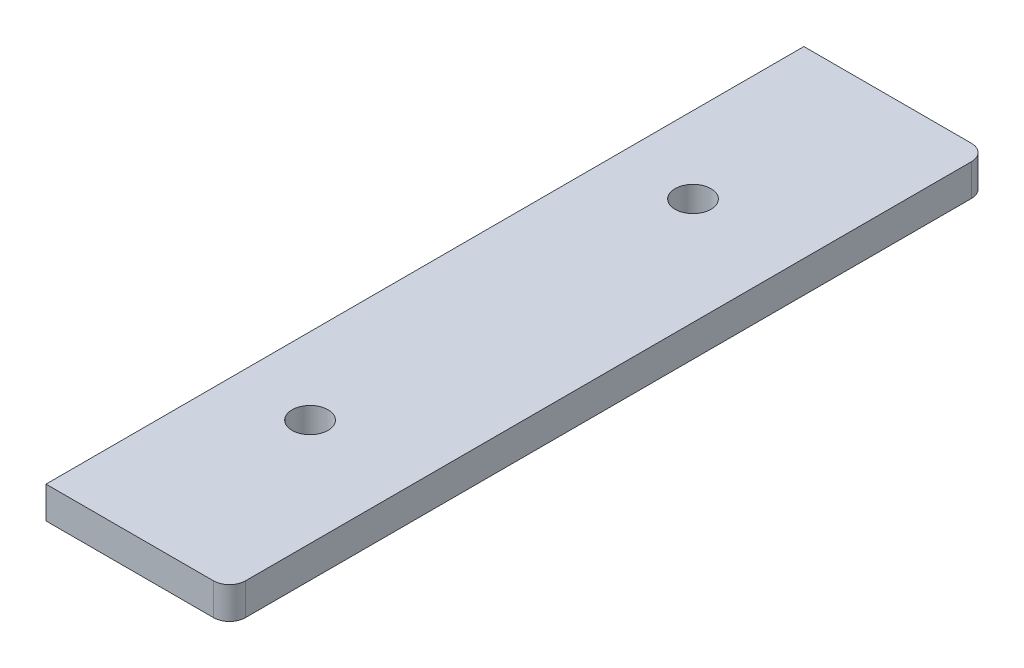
SolidWorks part; units mm, degrees
ref_plane "Front Plane" through (0, 0, 0) normal (0, 0, 1) x (1, 0, 0)
ref_plane "Top Plane" through (0, 0, 0) normal (0, 1, 0) x (1, 0, 0)
ref_plane "Right Plane" through (0, 0, 0) normal (1, 0, 0) x (0, 0, -1)
sketch "Sketch2" plane through (0, 0, 0) normal (0, 1, 0) x (1, 0, 0)
  line L0 (0, 0) -> (-56.1291, 0) construction
  line L1 (-18.2563, -75.4062) -> (18.2562, -75.4062)
  line L2 (-18.2563, -75.4062) -> (-18.2563, 75.4062)
  line L3 (-18.2563, 75.4062) -> (18.2562, 75.4062)
  line L4 (18.2562, -75.4062) -> (18.2562, 75.4062)
  line L5 (-18.2563, -75.4062) -> (18.2562, 75.4062) construction
  line L6 (-18.2563, 75.4062) -> (18.2562, -75.4062) construction
  circle A0 centre (-3.0163, 38.1) radius 3.5719
  circle A1 centre (-3.0162, -38.1) radius 3.5719
  point P0 (0, 0)
  point P10 (0, 0)
  point P13 (0, 0)
  point P14 (0, 0)
  point P15 (24.6062, 75.4062)
  dimension "D3" = 7.1437
  dimension "D1" = 150.8125
  dimension "D2" = 36.5125
  dimension "D4" = 76.2
  dimension "D5" = 15.24
extrude "Boss-Extrude1" add sketch "Sketch2" along normal blind 6.35
fillet "Fillet1" radius 3.175 2 edges at (18.2562, 3.175, 75.4062) (18.2562, 3.175, -75.4062)
